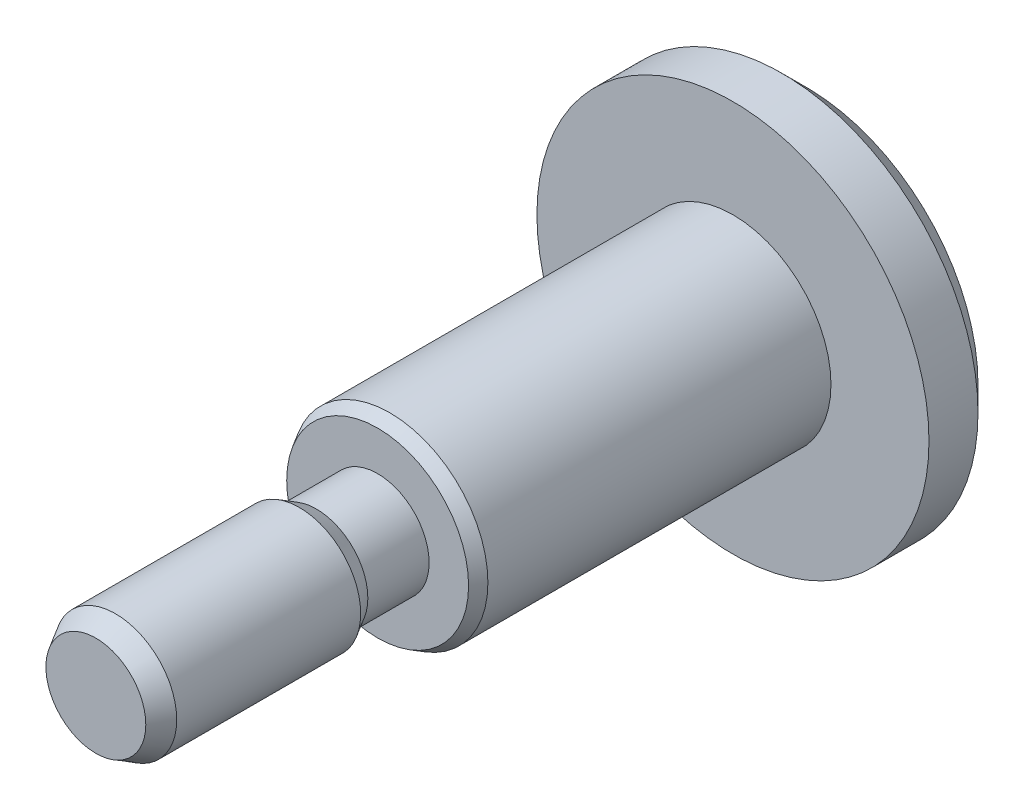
SolidWorks part; units mm, degrees
ref_plane "Plan1" through (0, 0, 0) normal (0, 0, 1) x (1, 0, 0)
ref_plane "Plan2" through (0, 0, 0) normal (0, 1, 0) x (1, 0, 0)
ref_plane "Plan3" through (0, 0, 0) normal (1, 0, 0) x (0, 0, -1)
sketch "Esquisse1" plane through (0, 0, 0) normal (0, 0, 1) x (1, 0, 0)
  circle A0 centre (0, 0) radius 8
  dimension "D1" = 16
extrude "Base-Extrusion" add sketch "Esquisse1" along normal blind 3
sketch "Esquisse2" plane through (0, 0, 3) normal (0, 0, 1) x (1, 0, 0)
  circle A0 centre (0, 0) radius 4
  dimension "D1" = 8
extrude "Boss.-Extru.1" add sketch "Esquisse2" along normal blind 14.5
chamfer "Chanfrein2" distance 0.5 angle 30
chamfer "Chanfrein3" distance 1 angle 45
sketch "Esquisse5" plane through (0, 0, 17.5) normal (0, 0, 1) x (1, 0, 0)
  circle A0 centre (0, 0) radius 2.1
extrude "Boss.-Extru.2" add sketch "Esquisse5" along normal blind 2.5
sketch "Esquisse6" plane through (0, 0, 20) normal (0, 0, 1) x (1, 0, 0)
  circle A0 centre (0, 0) radius 2.5
extrude "Boss.-Extru.3" add sketch "Esquisse6" along normal blind 9
chamfer "Chanfrein4" distance 0.8 angle 30
chamfer "Chanfrein7" distance 0.4 angle 60
